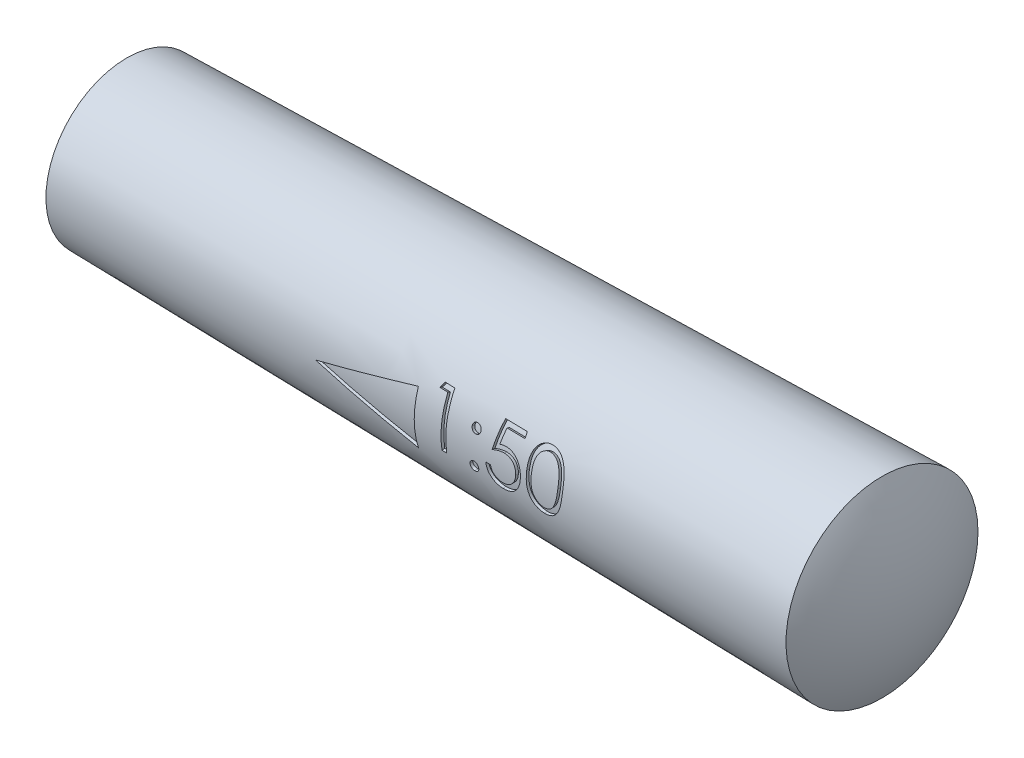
SolidWorks part; units mm, degrees
ref_plane "Front Plane" through (0, 0, 0) normal (0, 0, 1) x (1, 0, 0)
ref_plane "Top Plane" through (0, 0, 0) normal (0, 1, 0) x (1, 0, 0)
ref_plane "Right Plane" through (0, 0, 0) normal (1, 0, 0) x (0, 0, -1)
sketch "Sketch1" plane through (0, 0, 0) normal (1, 0, 0) x (0, 0, -1)
  circle A0 centre (0, 0) radius 1.5
  dimension "D1" = 3
extrude "Extrude1" add sketch "Sketch1" along normal mid plane 14
draft "Draft1" type of draft neutral plane draft angle 1.146 faces to draft 1 parameters "D1"=1.146
sketch "Sketch2" plane through (0, 0, 0) normal (0, 0, 1) x (1, 0, 0)
  line L0 (-7, 0) -> (-7, 1.5)
  line L1 (-7, 1.5) -> (-7, -1.5) construction
  line L2 (-7, 0) -> (-7.45, 0)
  line L3 (-7.45, 0) -> (-7.45, -1.64) construction
  line L4 (7, 0) -> (7, 1.78)
  line L5 (7, -1.78) -> (7, 1.78) construction
  line L6 (7, 0) -> (7.45, 0)
  line L7 (7.45, 0) -> (7.45, -1.64) construction
  line L8 (-7, -1.5) -> (7, -1.78) construction
  arc A0 (-7.45, 0) -> (-7, 1.5) centre (-4.725, 0) cw
  arc A1 (7.45, 0) -> (7, 1.78) centre (3.7045, 0) ccw
  point P14 (0, -1.64)
revolve "Revolve1" add sketch "Sketch2" angle 360 about L2
sketch "Sketch5" plane through (0, 0, 0) normal (0, 0, 1) x (1, 0, 0)
  line L0 (0, 1.64) -> (0, -1.64) construction
  line L1 (7, 1.78) -> (-7, 1.5) construction
  line L2 (-7, -1.5) -> (7, -1.78) construction
ref_plane "Plane2" through (0, 0, 0) normal (-0.02, 0, 0.9998) x (0.9998, 0, 0.02)
sketch "Sketch6" plane through (0, 0, 0) normal (-0.02, 0, 0.9998) x (0.9998, 0, 0.02)
  line L0 (0, 0) -> (0, 0.5)
  line L1 (0, 1.64) -> (0, -1.64) construction
  line L2 (0, 0.5) -> (-1.866, 0)
  line L3 (-1.866, 0) -> (0, -0.5)
  line L4 (0, -0.5) -> (0, 0)
  line L5 (0, -0.25) -> (3, -0.25) construction
  text T0 "1:50" font "Century Gothic" height 1
  dimension "D1" = 1
  dimension "D2" = 30
  dimension "D3" = 3
wrap "Wrap2" sketch "Sketch6" wrap type deboss source sketch "Sketch6" thickness 0.05 parameters "D1"=0.05
equation "\"D2@Sketch2\" = \"D1@Sketch2\""
